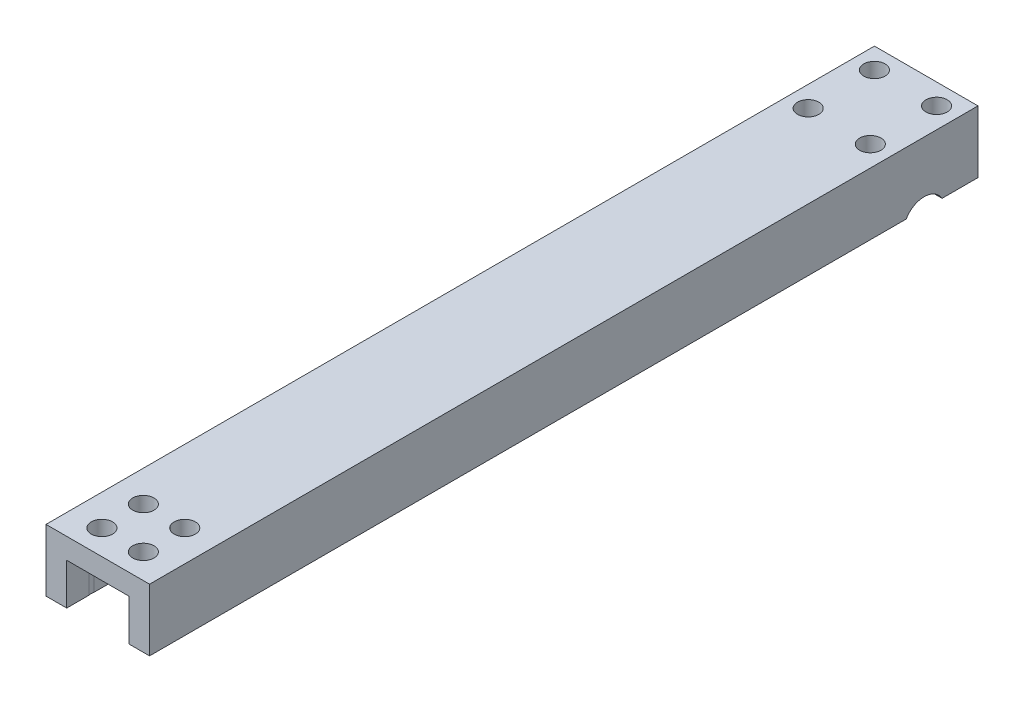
SolidWorks part; units mm, degrees
ref_plane "Front" through (0, 0, 0) normal (0, 0, 1) x (1, 0, 0)
ref_plane "Top" through (0, 0, 0) normal (0, 1, 0) x (1, 0, 0)
ref_plane "SAGITTAL" through (0, 0, 0) normal (1, 0, 0) x (0, 0, -1)
sketch "Sketch1" plane through (0, 0, 0) normal (0, 0, 1) x (1, 0, 0)
  line L0 (0, 0) -> (0, 9.525) construction
  line L1 (-7.9375, 0) -> (7.9375, 0)
  line L2 (-7.9375, 0) -> (-7.9375, 9.525)
  line L3 (-7.9375, 9.525) -> (7.9375, 9.525)
  line L4 (7.9375, 0) -> (7.9375, 9.525)
  dimension "D1" = 9.525
  dimension "D2" = 15.875
extrude "Extrude1" add sketch "Sketch1" along normal mid plane 127
hole_wizard "#4 Clearance Hole1" positions "Sketch3" profile "Sketch2" hole size "#4" standard "Ansi Inch"
sketch "Sketch3" plane through (0, 9.525, 0) normal (0, 1, 0) x (-1, 0, 0)
  line L0 (0, -63.5) -> (0, 63.5) construction
  line L1 (-7.9375, -63.5) -> (7.9375, -63.5) construction
  line L2 (-7.9375, 63.5) -> (7.9375, 63.5) construction
  point P0 (3.175, 59.69)
  point P9 (3.175, 53.34)
  point P12 (-3.175, 53.34)
  point P13 (-3.175, 59.69)
  dimension "D1" = 6.35
  dimension "D2" = 6.35
  dimension "D3" = 3.81
sketch "Sketch2" plane through (-3.175, 9.525, 59.69) normal (1, 0, 0) x (0, 0, 1)
  line L0 (0, 0) -> (0, 9.525)
  line L1 (0, 9.525) -> (1.6319, 9.525)
  line L2 (1.6319, 9.525) -> (1.6319, 0)
  line L5 (1.6319, 0) -> (0, 0)
  line L11 (0, -6.35) -> (0, 107.95) construction
  dimension "Thru Hole Dia." = 3.2639
  dimension "Thru Hole Depth" = 9.525
sketch "Sketch4" plane through (0, 0, -63.5) normal (0, 0, -1) x (-1, 0, 0)
  line L0 (0, 0) -> (0, 6.35) construction
  line L1 (-4.7625, 6.35) -> (4.7625, 6.35)
  line L2 (-4.7625, 6.35) -> (-4.7625, -10.375)
  line L3 (-4.7625, -10.375) -> (4.7625, -10.375)
  line L4 (4.7625, 6.35) -> (4.7625, -10.375)
  line L5 (7.9375, 0) -> (-7.9375, 0) construction
  dimension "D1" = 9.525
  dimension "D2" = 6.35
extrude "Cut-Extrude1" cut sketch "Sketch4" against normal through all from offset 20.32
hole_wizard "#4 Clearance Hole2" positions "Sketch6" profile "Sketch5" hole size "#4" standard "Ansi Inch"
sketch "Sketch6" plane through (0, 9.525, 0) normal (0, 1, 0) x (-1, 0, 0)
  line L0 (0, 0) -> (0, -63.5) construction
  line L1 (-7.9375, -63.5) -> (7.9375, -63.5) construction
  point P0 (-4.7625, -50.165)
  point P8 (-4.7625, -60.325)
  point P11 (4.7625, -60.325)
  point P12 (4.7625, -50.165)
  dimension "D1" = 9.525
  dimension "D2" = 10.16
  dimension "D3" = 3.175
sketch "Sketch5" plane through (4.7625, 9.525, -50.165) normal (1, 0, 0) x (0, 0, 1)
  line L0 (0, 0) -> (0, 9.525)
  line L1 (0, 9.525) -> (1.6319, 9.525)
  line L2 (1.6319, 9.525) -> (1.6319, 0)
  line L5 (1.6319, 0) -> (0, 0)
  line L11 (0, -6.35) -> (0, 107.95) construction
  dimension "Thru Hole Dia." = 3.2639
  dimension "Thru Hole Depth" = 9.525
sketch "Sketch7" plane through (7.9375, 0, 0) normal (1, 0, 0) x (0, 0, -1)
  line L0 (63.5, 0) -> (63.5, 9.525) construction
  line L1 (-63.5, 0) -> (63.5, 0) construction
  circle A0 centre (55.245, -1.5875) radius 3.175
  dimension "D1" = 6.35
  dimension "D2" = 8.255
  dimension "D3" = 1.5875
extrude "Cut-Extrude2" cut sketch "Sketch7" against normal through all
